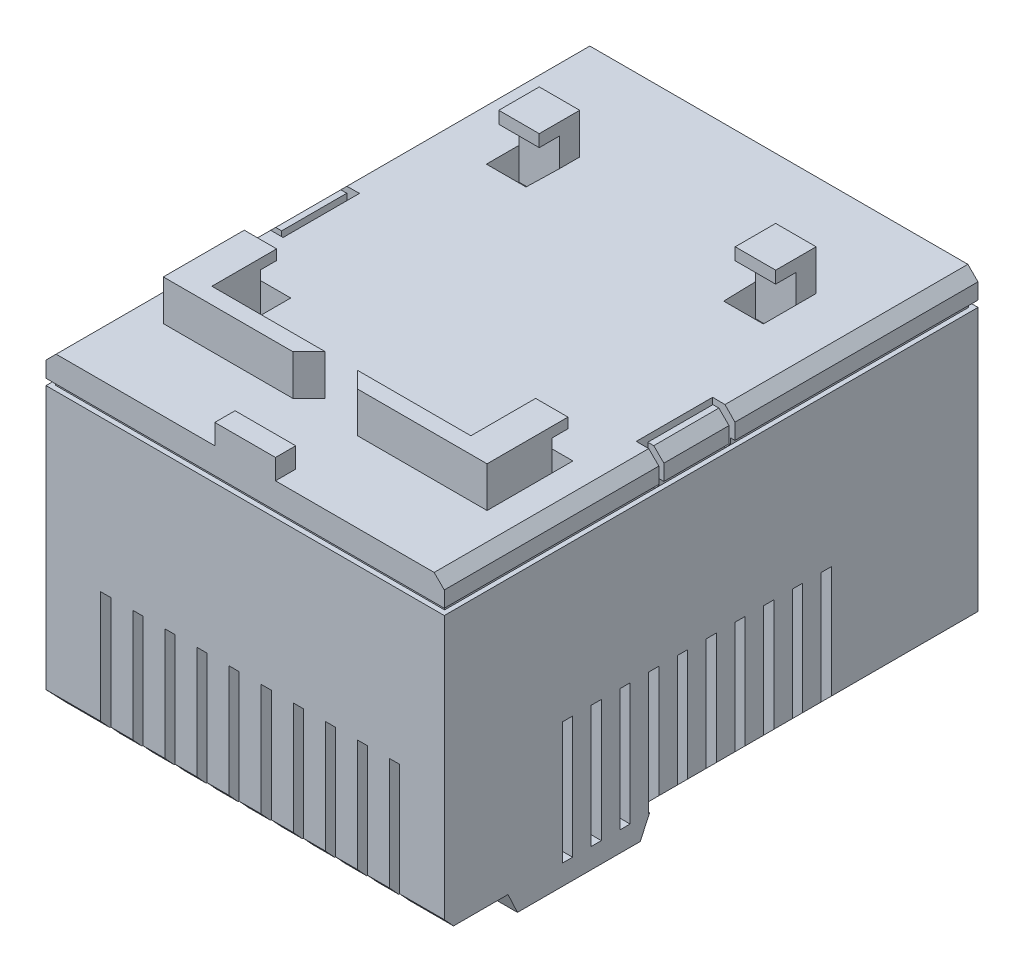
SolidWorks part; units mm, degrees
ref_plane "Спереди" through (0, 0, 0) normal (0, 0, 1) x (1, 0, 0)
ref_plane "Сверху" through (0, 0, 0) normal (0, 1, 0) x (1, 0, 0)
ref_plane "Справа" through (0, 0, 0) normal (1, 0, 0) x (0, 0, -1)
ref_plane "Плоскость1" through (0, -19.94, 0) normal (0, -1, 0) x (1, 0, 0)
sketch "Эскиз1" plane through (0, -19.94, 0) normal (0, -1, 0) x (1, 0, 0)
  line L0 (25, 0) -> (25, 67)
  line L1 (25, 67) -> (-25, 67)
  line L2 (-25, 67) -> (-25, 0)
  line L3 (-25, 0) -> (25, 0)
extrude "Бобышка-Вытянуть1" add sketch "Эскиз1" against normal blind 38.38
sketch "Эскиз2" plane through (0, 18.44, 0) normal (0, 1, 0) x (-1, 0, 0)
  line L0 (17.38, 12.7) -> (12.3, 12.7)
  line L1 (12.3, 12.7) -> (12.3, 15.24)
  line L2 (12.3, 15.24) -> (17.38, 15.24)
  line L3 (17.38, 15.24) -> (17.38, 12.7)
extrude "Бобышка-Вытянуть2" add sketch "Эскиз2" along normal blind 5.08
sketch "Эскиз3" plane through (0, 0, 15.24) normal (0, 0, 1) x (1, 0, 0)
  line L0 (-12.3, 21.996) -> (-17.38, 21.996)
  line L1 (-17.38, 21.996) -> (-17.38, 23.52)
  line L2 (-17.38, 23.52) -> (-12.3, 23.52)
  line L3 (-12.3, 23.52) -> (-12.3, 21.996)
extrude "Бобышка-Вытянуть3" add sketch "Эскиз3" along normal blind 2.54
sketch "Эскиз4" plane through (0, 18.44, 0) normal (0, 1, 0) x (-1, 0, 0)
  line L0 (-20.32, 56.95) -> (-4.064, 56.95)
  line L1 (-4.064, 56.95) -> (-4.064, 54.918)
  line L2 (-4.064, 54.918) -> (-16.256, 54.918)
  line L3 (-16.256, 54.918) -> (-16.256, 48.822)
  line L4 (-16.256, 48.822) -> (-20.32, 48.822)
  line L5 (-20.32, 48.822) -> (-20.32, 56.95)
extrude "Бобышка-Вытянуть4" add sketch "Эскиз4" along normal blind 5.08
sketch "Эскиз5" plane through (0, 0, 48.822) normal (0, 0, -1) x (-1, 0, 0)
  line L0 (-16.256, 23.52) -> (-16.256, 22.25)
  line L1 (-16.256, 22.25) -> (-20.32, 22.25)
  line L2 (-20.32, 22.25) -> (-20.32, 23.52)
  line L3 (-20.32, 23.52) -> (-16.256, 23.52)
extrude "Бобышка-Вытянуть5" add sketch "Эскиз5" along normal blind 2.032
sketch "Эскиз6" plane through (0, 18.44, 0) normal (0, 1, 0) x (-1, 0, 0)
  line L0 (16.256, 54.918) -> (4.064, 54.918)
  line L1 (4.064, 54.918) -> (4.064, 56.95)
  line L2 (4.064, 56.95) -> (20.32, 56.95)
  line L3 (20.32, 56.95) -> (20.32, 48.822)
  line L4 (20.32, 48.822) -> (16.256, 48.822)
  line L5 (16.256, 48.822) -> (16.256, 54.918)
extrude "Бобышка-Вытянуть6" add sketch "Эскиз6" along normal blind 5.08
sketch "Эскиз7" plane through (0, 0, 48.822) normal (0, 0, -1) x (-1, 0, 0)
  line L0 (20.32, 23.52) -> (20.32, 22.25)
  line L1 (20.32, 22.25) -> (16.256, 22.25)
  line L2 (16.256, 22.25) -> (16.256, 23.52)
  line L3 (16.256, 23.52) -> (20.32, 23.52)
extrude "Бобышка-Вытянуть7" add sketch "Эскиз7" along normal blind 2.032
sketch "Эскиз8" plane through (0, 18.44, 0) normal (0, 1, 0) x (-1, 0, 0)
  line L0 (-12.3, 12.7) -> (-17.38, 12.7)
  line L1 (-17.38, 12.7) -> (-17.38, 15.24)
  line L2 (-17.38, 15.24) -> (-12.3, 15.24)
  line L3 (-12.3, 15.24) -> (-12.3, 12.7)
extrude "Бобышка-Вытянуть8" add sketch "Эскиз8" along normal blind 5.08
sketch "Эскиз9" plane through (0, 0, 15.24) normal (0, 0, 1) x (1, 0, 0)
  line L0 (17.38, 21.996) -> (12.3, 21.996)
  line L1 (12.3, 21.996) -> (12.3, 23.52)
  line L2 (12.3, 23.52) -> (17.38, 23.52)
  line L3 (17.38, 23.52) -> (17.38, 21.996)
extrude "Бобышка-Вытянуть9" add sketch "Эскиз9" along normal blind 2.54
sketch "Эскиз10" plane through (0, -19.94, 0) normal (0, -1, 0) x (1, 0, 0)
  line L0 (-4.775, 47.47) -> (-6.045, 47.47)
  line L1 (-6.045, 47.47) -> (-6.045, 18.415)
  line L2 (-6.045, 18.415) -> (-4.775, 18.415)
  line L3 (-4.775, 18.415) -> (-4.775, 47.47)
extrude "Вырез-Вытянуть1" cut sketch "Эскиз10" against normal blind 2.54
sketch "Эскиз11" plane through (0, -19.94, 0) normal (0, -1, 0) x (1, 0, 0)
  line L0 (-8.805, 47.47) -> (-10.075, 47.47)
  line L1 (-10.075, 47.47) -> (-10.075, 18.415)
  line L2 (-10.075, 18.415) -> (-8.805, 18.415)
  line L3 (-8.805, 18.415) -> (-8.805, 47.47)
extrude "Вырез-Вытянуть2" cut sketch "Эскиз11" against normal blind 2.54
sketch "Эскиз12" plane through (0, -19.94, 0) normal (0, -1, 0) x (1, 0, 0)
  line L0 (-12.835, 47.47) -> (-14.105, 47.47)
  line L1 (-14.105, 47.47) -> (-14.105, 18.415)
  line L2 (-14.105, 18.415) -> (-12.835, 18.415)
  line L3 (-12.835, 18.415) -> (-12.835, 47.47)
extrude "Вырез-Вытянуть3" cut sketch "Эскиз12" against normal blind 2.54
sketch "Эскиз13" plane through (0, -19.94, 0) normal (0, -1, 0) x (1, 0, 0)
  line L0 (-16.865, 47.47) -> (-18.135, 47.47)
  line L1 (-18.135, 47.47) -> (-18.135, 18.415)
  line L2 (-18.135, 18.415) -> (-16.865, 18.415)
  line L3 (-16.865, 18.415) -> (-16.865, 47.47)
extrude "Вырез-Вытянуть4" cut sketch "Эскиз13" against normal blind 2.54
sketch "Эскиз14" plane through (0, -19.94, 0) normal (0, -1, 0) x (1, 0, 0)
  line L0 (19.405, 47.47) -> (18.135, 47.47)
  line L1 (18.135, 47.47) -> (18.135, 18.415)
  line L2 (18.135, 18.415) -> (19.405, 18.415)
  line L3 (19.405, 18.415) -> (19.405, 47.47)
extrude "Вырез-Вытянуть5" cut sketch "Эскиз14" against normal blind 2.54
sketch "Эскиз15" plane through (0, -19.94, 0) normal (0, -1, 0) x (1, 0, 0)
  line L0 (15.375, 47.47) -> (14.105, 47.47)
  line L1 (14.105, 47.47) -> (14.105, 18.415)
  line L2 (14.105, 18.415) -> (15.375, 18.415)
  line L3 (15.375, 18.415) -> (15.375, 47.47)
extrude "Вырез-Вытянуть6" cut sketch "Эскиз15" against normal blind 2.54
sketch "Эскиз16" plane through (0, -19.94, 0) normal (0, -1, 0) x (1, 0, 0)
  line L0 (11.345, 47.47) -> (10.075, 47.47)
  line L1 (10.075, 47.47) -> (10.075, 18.415)
  line L2 (10.075, 18.415) -> (11.345, 18.415)
  line L3 (11.345, 18.415) -> (11.345, 47.47)
extrude "Вырез-Вытянуть7" cut sketch "Эскиз16" against normal blind 2.54
sketch "Эскиз17" plane through (0, -19.94, 0) normal (0, -1, 0) x (1, 0, 0)
  line L0 (7.315, 47.47) -> (6.045, 47.47)
  line L1 (6.045, 47.47) -> (6.045, 18.415)
  line L2 (6.045, 18.415) -> (7.315, 18.415)
  line L3 (7.315, 18.415) -> (7.315, 47.47)
extrude "Вырез-Вытянуть8" cut sketch "Эскиз17" against normal blind 2.54
sketch "Эскиз18" plane through (0, -19.94, 0) normal (0, -1, 0) x (1, 0, 0)
  line L0 (3.285, 47.47) -> (2.015, 47.47)
  line L1 (2.015, 47.47) -> (2.015, 18.415)
  line L2 (2.015, 18.415) -> (3.285, 18.415)
  line L3 (3.285, 18.415) -> (3.285, 47.47)
extrude "Вырез-Вытянуть9" cut sketch "Эскиз18" against normal blind 2.54
sketch "Эскиз19" plane through (0, -19.94, 0) normal (0, -1, 0) x (1, 0, 0)
  line L0 (-10, 58.999) -> (25, 58.999)
  line L1 (25, 58.999) -> (25, 41.219)
  line L2 (25, 41.219) -> (-10, 41.219)
  arc A0 (-10, 41.219) -> (-10, 58.999) centre (-10, 50.109) cw
extrude "Бобышка-Вытянуть10" add sketch "Эскиз19" along normal blind 2.54
sketch "Эскиз20" plane through (0, -19.94, 0) normal (0, -1, 0) x (1, 0, 0)
  line L0 (-0.745, 18.415) -> (-0.745, 41.219)
  line L1 (-0.745, 41.219) -> (-2.015, 41.219)
  line L2 (-2.015, 41.219) -> (-2.015, 18.415)
  line L3 (-2.015, 18.415) -> (-0.745, 18.415)
extrude "Вырез-Вытянуть10" cut sketch "Эскиз20" against normal blind 2.54
sketch "Эскиз21" plane through (0, 0, 41.219) normal (0, 0, -1) x (-1, 0, 0)
  line L0 (0.745, -19.94) -> (2.015, -19.94)
  line L1 (2.015, -19.94) -> (2.015, -17.4)
  line L2 (2.015, -17.4) -> (0.745, -17.4)
  line L3 (0.745, -17.4) -> (0.745, -19.94)
extrude "Вырез-Вытянуть11" cut sketch "Эскиз21" against normal blind 6.251
sketch "Эскиз22" plane through (25, 0, 0) normal (1, 0, 0) x (0, 0, -1)
  line L0 (-52.1627, -4.588) -> (-52.1627, -19.94)
  line L1 (-52.1627, -19.94) -> (-50.8927, -19.94)
  line L2 (-50.8927, -19.94) -> (-50.8927, -4.588)
  line L3 (-50.8927, -4.588) -> (-52.1627, -4.588)
extrude "Вырез-Вытянуть12" cut sketch "Эскиз22" against normal blind 2.54
sketch "Эскиз23" plane through (25, 0, 0) normal (1, 0, 0) x (0, 0, -1)
  line L0 (-48.5541, -4.588) -> (-48.5541, -19.94)
  line L1 (-48.5541, -19.94) -> (-47.2841, -19.94)
  line L2 (-47.2841, -19.94) -> (-47.2841, -4.588)
  line L3 (-47.2841, -4.588) -> (-48.5541, -4.588)
extrude "Вырез-Вытянуть13" cut sketch "Эскиз23" against normal blind 2.54
sketch "Эскиз24" plane through (25, 0, 0) normal (1, 0, 0) x (0, 0, -1)
  line L0 (-44.9455, -4.588) -> (-44.9455, -19.94)
  line L1 (-44.9455, -19.94) -> (-43.6755, -19.94)
  line L2 (-43.6755, -19.94) -> (-43.6755, -4.588)
  line L3 (-43.6755, -4.588) -> (-44.9455, -4.588)
extrude "Вырез-Вытянуть14" cut sketch "Эскиз24" against normal blind 2.54
sketch "Эскиз25" plane through (0, 18.44, 0) normal (0, 1, 0) x (-1, 0, 0)
  line L0 (3.81, 64.46) -> (-3.81, 64.46)
  line L1 (-3.81, 64.46) -> (-3.81, 67)
  line L2 (-3.81, 67) -> (3.81, 67)
  line L3 (3.81, 67) -> (3.81, 64.46)
extrude "Бобышка-Вытянуть11" add sketch "Эскиз25" along normal blind 2.54
sketch "Эскиз26" plane through (25, 0, 0) normal (1, 0, 0) x (0, 0, -1)
  line L0 (-41.219, -19.94) -> (-40.0668, -19.94)
  line L1 (-40.0668, -19.94) -> (-40.0668, -4.588)
  line L2 (-40.0668, -4.588) -> (-41.3368, -4.588)
  line L3 (-41.3368, -4.588) -> (-41.3368, -19.94)
  line L4 (-41.3368, -19.94) -> (-41.219, -19.94)
extrude "Вырез-Вытянуть15" cut sketch "Эскиз26" against normal blind 2.54
sketch "Эскиз27" plane through (25, 0, 0) normal (1, 0, 0) x (0, 0, -1)
  line L0 (-37.7282, -4.588) -> (-37.7282, -19.94)
  line L1 (-37.7282, -19.94) -> (-36.4582, -19.94)
  line L2 (-36.4582, -19.94) -> (-36.4582, -4.588)
  line L3 (-36.4582, -4.588) -> (-37.7282, -4.588)
extrude "Вырез-Вытянуть16" cut sketch "Эскиз27" against normal blind 2.54
sketch "Эскиз28" plane through (25, 0, 0) normal (1, 0, 0) x (0, 0, -1)
  line L0 (-34.1195, -4.588) -> (-34.1195, -19.94)
  line L1 (-34.1195, -19.94) -> (-32.8495, -19.94)
  line L2 (-32.8495, -19.94) -> (-32.8495, -4.588)
  line L3 (-32.8495, -4.588) -> (-34.1195, -4.588)
extrude "Вырез-Вытянуть17" cut sketch "Эскиз28" against normal blind 2.54
sketch "Эскиз29" plane through (25, 0, 0) normal (1, 0, 0) x (0, 0, -1)
  line L0 (-30.5109, -4.588) -> (-30.5109, -19.94)
  line L1 (-30.5109, -19.94) -> (-29.2409, -19.94)
  line L2 (-29.2409, -19.94) -> (-29.2409, -4.588)
  line L3 (-29.2409, -4.588) -> (-30.5109, -4.588)
extrude "Вырез-Вытянуть18" cut sketch "Эскиз29" against normal blind 2.54
sketch "Эскиз30" plane through (25, 0, 0) normal (1, 0, 0) x (0, 0, -1)
  line L0 (-26.9023, -4.588) -> (-26.9023, -19.94)
  line L1 (-26.9023, -19.94) -> (-25.6323, -19.94)
  line L2 (-25.6323, -19.94) -> (-25.6323, -4.588)
  line L3 (-25.6323, -4.588) -> (-26.9023, -4.588)
extrude "Вырез-Вытянуть19" cut sketch "Эскиз30" against normal blind 2.54
sketch "Эскиз31" plane through (25, 0, 0) normal (1, 0, 0) x (0, 0, -1)
  line L0 (-23.2936, -4.588) -> (-23.2936, -19.94)
  line L1 (-23.2936, -19.94) -> (-22.0236, -19.94)
  line L2 (-22.0236, -19.94) -> (-22.0236, -4.588)
  line L3 (-22.0236, -4.588) -> (-23.2936, -4.588)
extrude "Вырез-Вытянуть20" cut sketch "Эскиз31" against normal blind 2.54
sketch "Эскиз32" plane through (25, 0, 0) normal (1, 0, 0) x (0, 0, -1)
  line L0 (-19.685, -4.588) -> (-19.685, -19.94)
  line L1 (-19.685, -19.94) -> (-18.415, -19.94)
  line L2 (-18.415, -19.94) -> (-18.415, -4.588)
  line L3 (-18.415, -4.588) -> (-19.685, -4.588)
extrude "Вырез-Вытянуть21" cut sketch "Эскиз32" against normal blind 2.54
sketch "Эскиз33" plane through (0, -19.94, 0) normal (0, -1, 0) x (1, 0, 0)
  line L0 (-22.46, 19.685) -> (-25, 19.685)
  line L1 (-25, 19.685) -> (-25, 18.415)
  line L2 (-25, 18.415) -> (-22.46, 18.415)
  line L3 (-22.46, 18.415) -> (-22.46, 19.685)
extrude "Вырез-Вытянуть22" cut sketch "Эскиз33" against normal blind 15.352
sketch "Эскиз34" plane through (0, -19.94, 0) normal (0, -1, 0) x (1, 0, 0)
  line L0 (-22.46, 23.2936) -> (-25, 23.2936)
  line L1 (-25, 23.2936) -> (-25, 22.0236)
  line L2 (-25, 22.0236) -> (-22.46, 22.0236)
  line L3 (-22.46, 22.0236) -> (-22.46, 23.2936)
extrude "Вырез-Вытянуть23" cut sketch "Эскиз34" against normal blind 15.352
sketch "Эскиз35" plane through (0, -19.94, 0) normal (0, -1, 0) x (1, 0, 0)
  line L0 (-22.46, 26.9023) -> (-25, 26.9023)
  line L1 (-25, 26.9023) -> (-25, 25.6323)
  line L2 (-25, 25.6323) -> (-22.46, 25.6323)
  line L3 (-22.46, 25.6323) -> (-22.46, 26.9023)
extrude "Вырез-Вытянуть24" cut sketch "Эскиз35" against normal blind 15.352
sketch "Эскиз36" plane through (0, -19.94, 0) normal (0, -1, 0) x (1, 0, 0)
  line L0 (-22.46, 30.5109) -> (-25, 30.5109)
  line L1 (-25, 30.5109) -> (-25, 29.2409)
  line L2 (-25, 29.2409) -> (-22.46, 29.2409)
  line L3 (-22.46, 29.2409) -> (-22.46, 30.5109)
extrude "Вырез-Вытянуть25" cut sketch "Эскиз36" against normal blind 15.352
sketch "Эскиз37" plane through (0, -19.94, 0) normal (0, -1, 0) x (1, 0, 0)
  line L0 (-22.46, 34.1195) -> (-25, 34.1195)
  line L1 (-25, 34.1195) -> (-25, 32.8495)
  line L2 (-25, 32.8495) -> (-22.46, 32.8495)
  line L3 (-22.46, 32.8495) -> (-22.46, 34.1195)
extrude "Вырез-Вытянуть26" cut sketch "Эскиз37" against normal blind 15.352
sketch "Эскиз38" plane through (0, -19.94, 0) normal (0, -1, 0) x (1, 0, 0)
  line L0 (-22.46, 37.7282) -> (-25, 37.7282)
  line L1 (-25, 37.7282) -> (-25, 36.4582)
  line L2 (-25, 36.4582) -> (-22.46, 36.4582)
  line L3 (-22.46, 36.4582) -> (-22.46, 37.7282)
extrude "Вырез-Вытянуть27" cut sketch "Эскиз38" against normal blind 15.352
sketch "Эскиз39" plane through (0, -19.94, 0) normal (0, -1, 0) x (1, 0, 0)
  line L0 (-22.46, 41.3368) -> (-25, 41.3368)
  line L1 (-25, 41.3368) -> (-25, 40.0668)
  line L2 (-25, 40.0668) -> (-22.46, 40.0668)
  line L3 (-22.46, 40.0668) -> (-22.46, 41.3368)
extrude "Вырез-Вытянуть28" cut sketch "Эскиз39" against normal blind 15.352
sketch "Эскиз40" plane through (0, -19.94, 0) normal (0, -1, 0) x (1, 0, 0)
  line L0 (-22.46, 44.9455) -> (-25, 44.9455)
  line L1 (-25, 44.9455) -> (-25, 43.6755)
  line L2 (-25, 43.6755) -> (-22.46, 43.6755)
  line L3 (-22.46, 43.6755) -> (-22.46, 44.9455)
extrude "Вырез-Вытянуть29" cut sketch "Эскиз40" against normal blind 15.352
sketch "Эскиз41" plane through (0, -19.94, 0) normal (0, -1, 0) x (1, 0, 0)
  line L0 (-22.46, 48.5541) -> (-25, 48.5541)
  line L1 (-25, 48.5541) -> (-25, 47.2841)
  line L2 (-25, 47.2841) -> (-22.46, 47.2841)
  line L3 (-22.46, 47.2841) -> (-22.46, 48.5541)
extrude "Вырез-Вытянуть30" cut sketch "Эскиз41" against normal blind 15.352
sketch "Эскиз42" plane through (-25, 0, 0) normal (-1, 0, 0) x (0, 0, 1)
  line L0 (52.1627, -19.94) -> (52.1627, -4.588)
  line L1 (52.1627, -4.588) -> (50.8927, -4.588)
  line L2 (50.8927, -4.588) -> (50.8927, -19.94)
  line L3 (50.8927, -19.94) -> (52.1627, -19.94)
extrude "Вырез-Вытянуть31" cut sketch "Эскиз42" against normal blind 2.54
sketch "Эскиз43" plane through (0, 0, 67) normal (0, 0, 1) x (1, 0, 0)
  line L0 (19.405, -19.94) -> (19.405, -4.588)
  line L1 (19.405, -4.588) -> (18.135, -4.588)
  line L2 (18.135, -4.588) -> (18.135, -19.94)
  line L3 (18.135, -19.94) -> (19.405, -19.94)
extrude "Вырез-Вытянуть32" cut sketch "Эскиз43" against normal blind 2.54
sketch "Эскиз44" plane through (0, 0, 67) normal (0, 0, 1) x (1, 0, 0)
  line L0 (-16.865, -19.94) -> (-16.865, -4.588)
  line L1 (-16.865, -4.588) -> (-18.135, -4.588)
  line L2 (-18.135, -4.588) -> (-18.135, -19.94)
  line L3 (-18.135, -19.94) -> (-16.865, -19.94)
extrude "Вырез-Вытянуть33" cut sketch "Эскиз44" against normal blind 2.54
sketch "Эскиз45" plane through (0, 0, 67) normal (0, 0, 1) x (1, 0, 0)
  line L0 (-12.835, -19.94) -> (-12.835, -4.588)
  line L1 (-12.835, -4.588) -> (-14.105, -4.588)
  line L2 (-14.105, -4.588) -> (-14.105, -19.94)
  line L3 (-14.105, -19.94) -> (-12.835, -19.94)
extrude "Вырез-Вытянуть34" cut sketch "Эскиз45" against normal blind 2.54
sketch "Эскиз46" plane through (0, 0, 67) normal (0, 0, 1) x (1, 0, 0)
  line L0 (-8.805, -19.94) -> (-8.805, -4.588)
  line L1 (-8.805, -4.588) -> (-10.075, -4.588)
  line L2 (-10.075, -4.588) -> (-10.075, -19.94)
  line L3 (-10.075, -19.94) -> (-8.805, -19.94)
extrude "Вырез-Вытянуть35" cut sketch "Эскиз46" against normal blind 2.54
sketch "Эскиз47" plane through (0, 0, 67) normal (0, 0, 1) x (1, 0, 0)
  line L0 (-4.775, -19.94) -> (-4.775, -4.588)
  line L1 (-4.775, -4.588) -> (-6.045, -4.588)
  line L2 (-6.045, -4.588) -> (-6.045, -19.94)
  line L3 (-6.045, -19.94) -> (-4.775, -19.94)
extrude "Вырез-Вытянуть36" cut sketch "Эскиз47" against normal blind 2.54
sketch "Эскиз48" plane through (0, 0, 67) normal (0, 0, 1) x (1, 0, 0)
  line L0 (-0.745, -19.94) -> (-0.745, -4.588)
  line L1 (-0.745, -4.588) -> (-2.015, -4.588)
  line L2 (-2.015, -4.588) -> (-2.015, -19.94)
  line L3 (-2.015, -19.94) -> (-0.745, -19.94)
extrude "Вырез-Вытянуть37" cut sketch "Эскиз48" against normal blind 2.54
sketch "Эскиз49" plane through (0, 0, 67) normal (0, 0, 1) x (1, 0, 0)
  line L0 (3.285, -19.94) -> (3.285, -4.588)
  line L1 (3.285, -4.588) -> (2.015, -4.588)
  line L2 (2.015, -4.588) -> (2.015, -19.94)
  line L3 (2.015, -19.94) -> (3.285, -19.94)
extrude "Вырез-Вытянуть38" cut sketch "Эскиз49" against normal blind 2.54
sketch "Эскиз50" plane through (0, 0, 67) normal (0, 0, 1) x (1, 0, 0)
  line L0 (7.315, -19.94) -> (7.315, -4.588)
  line L1 (7.315, -4.588) -> (6.045, -4.588)
  line L2 (6.045, -4.588) -> (6.045, -19.94)
  line L3 (6.045, -19.94) -> (7.315, -19.94)
extrude "Вырез-Вытянуть39" cut sketch "Эскиз50" against normal blind 2.54
sketch "Эскиз51" plane through (0, 0, 67) normal (0, 0, 1) x (1, 0, 0)
  line L0 (11.345, -19.94) -> (11.345, -4.588)
  line L1 (11.345, -4.588) -> (10.075, -4.588)
  line L2 (10.075, -4.588) -> (10.075, -19.94)
  line L3 (10.075, -19.94) -> (11.345, -19.94)
extrude "Вырез-Вытянуть40" cut sketch "Эскиз51" against normal blind 2.54
sketch "Эскиз52" plane through (0, 0, 67) normal (0, 0, 1) x (1, 0, 0)
  line L0 (15.375, -19.94) -> (15.375, -4.588)
  line L1 (15.375, -4.588) -> (14.105, -4.588)
  line L2 (14.105, -4.588) -> (14.105, -19.94)
  line L3 (14.105, -19.94) -> (15.375, -19.94)
extrude "Вырез-Вытянуть41" cut sketch "Эскиз52" against normal blind 2.54
sketch "Эскиз53" plane through (0, -19.94, 0) normal (0, -1, 0) x (1, 0, 0)
  line L0 (12.8588, 11.9062) -> (-12.8588, 11.9062)
  line L1 (-12.8588, 7.1438) -> (12.8588, 7.1438)
  arc A0 (12.8588, 7.1438) -> (12.8588, 11.9062) centre (12.8588, 9.525) ccw
  arc A1 (-12.8588, 11.9062) -> (-12.8588, 7.1438) centre (-12.8588, 9.525) ccw
extrude "Вырез-Вытянуть42" cut sketch "Эскиз53" against normal blind 1.27
draft "Уклон1" type of draft neutral plane draft angle 45 faces to draft 1 parameters "D1"=45
draft "Уклон2" type of draft neutral plane draft angle 45 faces to draft 1 parameters "D1"=45
draft "Уклон3" type of draft neutral plane draft angle 25 faces to draft 3 parameters "D1"=25
hole_wizard "Отверстие с зазором M3.51" positions "Эскиз55" profile "Эскиз54" hole size "M3.5" standard "Ansi Metric"
sketch "Эскиз55" plane through (0, 0, 0) normal (0, 0, -1) x (-1, 0, 0)
  point P0 (-12.3825, 1.3455)
  point P1 (-7.62, 1.3455)
  point P2 (-2.8575, 1.3455)
  point P3 (1.905, 1.3455)
  point P4 (6.6675, 1.3455)
  point P5 (11.43, 1.3455)
sketch "Эскиз54" plane through (12.3825, 1.3455, 0) normal (1, 0, 0) x (0, 1, 0)
  line L0 (0, 0) -> (0, 2.8575)
  line L1 (0, 2.8575) -> (1.905, 2.8575)
  line L2 (1.905, 2.8575) -> (1.905, 0)
  line L5 (1.905, 0) -> (0, 0)
  line L10 (0, 2.8575) -> (-1.905, 2.8575) construction
  line L11 (0, -6.35) -> (0, 107.95) construction
  dimension "Диаметр отверстия" = 3.81
  dimension "Глубина отверстия" = 2.8575
  dimension "Угол заточки сверла" = 180
hole_wizard "Отверстие1" positions "Эскиз57" profile "Эскиз56" legacy
sketch "Эскиз57" plane through (0, -22.48, 0) normal (0, -1, 0) x (-1, 0, 0)
  point P0 (-11.8767, -50.109)
  point P1 (10, -50.109)
sketch "Эскиз56" plane through (11.8767, -22.48, 50.109) normal (1, 0, 0) x (0, 0, -1)
  line L0 (0, 0) -> (0, 0.254)
  line L1 (0, 0.254) -> (5.08, 0.254)
  line L2 (5.08, 0.254) -> (5.08, 0)
  line L3 (5.08, 0) -> (0, 0)
  line L4 (0, 110) -> (0, -10) construction
  dimension "Диаметр" = 10.16
  dimension "Глубина" = 0.254
hole_wizard "Отверстие с зазором M3.52" positions "Эскиз59" profile "Эскиз58" hole size "M3.5" standard "Ansi Metric"
sketch "Эскиз59" plane through (0, -18.67, 0) normal (0, -1, 0) x (-1, 0, 0)
  point P0 (-12.3825, -9.525)
  point P1 (-7.62, -9.525)
  point P2 (-2.8575, -9.525)
  point P3 (1.905, -9.525)
  point P4 (6.6675, -9.525)
  point P5 (11.43, -9.525)
sketch "Эскиз58" plane through (12.3825, -18.67, 9.525) normal (1, 0, 0) x (0, 0, -1)
  line L0 (0, 0) -> (0, 3.33)
  line L1 (0, 3.33) -> (1.905, 3.33)
  line L2 (1.905, 3.33) -> (1.905, 0)
  line L5 (1.905, 0) -> (0, 0)
  line L10 (0, 3.33) -> (-1.905, 3.33) construction
  line L11 (0, -6.35) -> (0, 107.95) construction
  dimension "Диаметр отверстия" = 3.81
  dimension "Глубина отверстия" = 3.33
  dimension "Угол заточки сверла" = 180
chamfer "Фаска1" distance 1.27 angle 45 20 edges at (-25, -19.94, 9.2075) (25, -19.94, 28.0716) (25, 18.44, 33.5) (-25, -19.94, 46.1148) (25, -19.94, 35.2889) (-25, -19.94, 42.5061) (-25, -19.94, 38.8975) (-25, -19.94, 49.7234) (-25, -19.94, 35.2889) (25, -19.94, 31.6802) (-25, -19.94, 31.6802) (25, -19.94, 38.8975) (-25, -19.94, 28.0716) (25, -19.94, 9.2075) (-25, -19.94, 24.463) (-25, -19.94, 59.5814) (-25, -19.94, 20.8543) (-25, 18.44, 33.5) (25, -19.94, 20.8543) (25, -19.94, 24.463)
sketch "Эскиз60" plane through (25, 0, 0) normal (1, 0, 0) x (0, 0, -1)
  line L0 (-65.8434, -19.94) -> (-67, -18.67)
  line L1 (-67, -18.67) -> (-67.9766, -18.67)
  line L2 (-67.9766, -18.67) -> (-67.9766, -20.433)
  line L3 (-67.9766, -20.433) -> (-65.8434, -20.433)
  line L4 (-65.8434, -20.433) -> (-65.8434, -19.94)
extrude "Вырез-Вытянуть43" cut sketch "Эскиз60" against normal up to surface (50 mm away)
sketch "Эскиз61" plane through (0, -22.226, 0) normal (0, -1, 0) x (1, 0, 0)
  circle A0 centre (-10, 50.109) radius 4.8699
  circle A1 centre (-10, 50.109) radius 4.5414
  circle A2 centre (11.8767, 50.109) radius 4.8744
  circle A3 centre (11.8767, 50.109) radius 4.5621
extrude "Вырез-Вытянуть44" cut sketch "Эскиз61" against normal blind 2
sketch "Эскиз62" plane through (0, -22.226, 0) normal (0, -1, 0) x (1, 0, 0)
  line L0 (-8.0201, 51.1697) -> (-11.0607, 48.1291)
  line L1 (-11.0607, 48.1291) -> (-11.9799, 49.0483)
  line L2 (-11.9799, 49.0483) -> (-8.9393, 52.0889)
  line L3 (-8.9393, 52.0889) -> (-8.0201, 51.1697)
  line L4 (13.5284, 51.6311) -> (11.3449, 47.9268)
  line L5 (11.3449, 47.9268) -> (10.225, 48.5869)
  line L6 (10.225, 48.5869) -> (12.4085, 52.2912)
  line L7 (12.4085, 52.2912) -> (13.5284, 51.6311)
extrude "Вырез-Вытянуть45" cut sketch "Эскиз62" against normal blind 2
sketch "Эскиз63" plane through (0, -15.34, 0) normal (0, -1, 0) x (1, 0, 0)
  circle A0 centre (-11.43, 9.525) radius 1.7849
  circle A1 centre (-11.43, 9.525) radius 1.669
extrude "Вырез-Вытянуть46" cut sketch "Эскиз63" against normal blind 2
sketch "Эскиз64" plane through (0, -15.34, 0) normal (0, -1, 0) x (1, 0, 0)
  line L0 (-10.1532, 10.7545) -> (-12.8801, 8.5051)
  line L1 (-12.8801, 8.5051) -> (-12.7247, 8.2963)
  line L2 (-12.7247, 8.2963) -> (-9.9775, 10.5624)
  line L3 (-9.9775, 10.5624) -> (-10.1532, 10.7545)
extrude "Вырез-Вытянуть47" cut sketch "Эскиз64" against normal blind 2
pattern_linear "Линейный массив1" count 6 spacing 4.75 along (1, 0, 0) of "Вырез-Вытянуть46", "Вырез-Вытянуть47"
sketch "Эскиз65" plane through (0, 0, 0) normal (0, 0, -1) x (-1, 0, 0)
  line L0 (19, -15.94) -> (17, -15.94)
  line L1 (19, -15.94) -> (19, 8.06)
  line L2 (19, 8.06) -> (17, 8.06)
  line L3 (17, -15.94) -> (17, 8.06)
  line L4 (16, -15.94) -> (14, -15.94)
  line L5 (16, -15.94) -> (16, -1.94)
  line L6 (16, -1.94) -> (14, -1.94)
  line L7 (14, -15.94) -> (14, -1.94)
  line L8 (-17, -15.94) -> (-19, -15.94)
  line L9 (-17, -15.94) -> (-17, 8.06)
  line L10 (-17, 8.06) -> (-19, 8.06)
  line L11 (-19, -15.94) -> (-19, 8.06)
  line L12 (13, -15.94) -> (11, -15.94)
  line L13 (13, -15.94) -> (13, -1.94)
  line L14 (13, -1.94) -> (11, -1.94)
  line L15 (11, -15.94) -> (11, -1.94)
  line L16 (10, -15.94) -> (8, -15.94)
  line L17 (10, -15.94) -> (10, -1.94)
  line L18 (10, -1.94) -> (8, -1.94)
  line L19 (8, -15.94) -> (8, -1.94)
  line L20 (7, -15.94) -> (5, -15.94)
  line L21 (7, -15.94) -> (7, -1.94)
  line L22 (7, -1.94) -> (5, -1.94)
  line L23 (5, -15.94) -> (5, -1.94)
  line L24 (4, -15.94) -> (2, -15.94)
  line L25 (4, -15.94) -> (4, -1.94)
  line L26 (4, -1.94) -> (2, -1.94)
  line L27 (2, -15.94) -> (2, -1.94)
  line L28 (1, -15.94) -> (-1, -15.94)
  line L29 (1, -15.94) -> (1, -1.94)
  line L30 (1, -1.94) -> (-1, -1.94)
  line L31 (-1, -15.94) -> (-1, -1.94)
  line L32 (-2, -15.94) -> (-4, -15.94)
  line L33 (-2, -15.94) -> (-2, -1.94)
  line L34 (-2, -1.94) -> (-4, -1.94)
  line L35 (-4, -15.94) -> (-4, -1.94)
  line L36 (-5, -15.94) -> (-7, -15.94)
  line L37 (-5, -15.94) -> (-5, -1.94)
  line L38 (-5, -1.94) -> (-7, -1.94)
  line L39 (-7, -15.94) -> (-7, -1.94)
  line L40 (-8, -15.94) -> (-10, -15.94)
  line L41 (-8, -15.94) -> (-8, -1.94)
  line L42 (-8, -1.94) -> (-10, -1.94)
  line L43 (-10, -15.94) -> (-10, -1.94)
  line L44 (-11, -15.94) -> (-13, -15.94)
  line L45 (-11, -15.94) -> (-11, -1.94)
  line L46 (-11, -1.94) -> (-13, -1.94)
  line L47 (-13, -15.94) -> (-13, -1.94)
  line L48 (-14, -15.94) -> (-16, -15.94)
  line L49 (-14, -15.94) -> (-14, -1.94)
  line L50 (-14, -1.94) -> (-16, -1.94)
  line L51 (-16, -15.94) -> (-16, -1.94)
extrude "Вырез-Вытянуть48" cut sketch "Эскиз65" against normal blind 2
sketch "Эскиз66" plane through (0, 18.44, 0) normal (0, 1, 0) x (-1, 0, 0)
  line L0 (25, 40.0668) -> (22.1658, 40.0668)
  line L1 (22.1658, 40.0668) -> (22.1658, 30.4778)
  line L2 (22.1658, 30.4778) -> (25, 30.5109)
  line L3 (25, 30.5109) -> (25, 31.2599)
  line L4 (25, 31.2599) -> (22.9834, 31.2599)
  line L5 (22.9834, 31.2599) -> (22.9834, 39.434)
  line L6 (22.9834, 39.434) -> (25, 39.434)
  line L7 (25, 39.434) -> (25, 40.0668)
  line L8 (-25, 39.434) -> (-25, 40.0668)
  line L9 (-22.9834, 39.434) -> (-25, 39.434)
  line L10 (-22.9834, 31.2599) -> (-22.9834, 39.434)
  line L11 (-25, 31.2599) -> (-22.9834, 31.2599)
  line L12 (-25, 30.5109) -> (-25, 31.2599)
  line L13 (-22.1658, 30.4778) -> (-25, 30.5109)
  line L14 (-22.1658, 40.0668) -> (-22.1658, 30.4778)
  line L15 (-25, 40.0668) -> (-22.1658, 40.0668)
extrude "Вырез-Вытянуть49" cut sketch "Эскиз66" against normal blind 4
sketch "Эскиз67" plane through (0, 18.44, 0) normal (0, 1, 0) x (-1, 0, 0)
  line L0 (20.32, 48.822) -> (20.32, 46.1692)
  line L1 (20.32, 46.1692) -> (15.1073, 46.1692)
  line L2 (15.1073, 46.1692) -> (15.1073, 54.0423)
  line L3 (15.1073, 54.0423) -> (11.257, 54.0423)
  line L4 (11.257, 54.0423) -> (11.257, 54.918)
  line L5 (11.257, 54.918) -> (16.256, 54.918)
  line L6 (16.256, 54.918) -> (16.256, 48.822)
  line L7 (16.256, 48.822) -> (20.32, 48.822)
  line L8 (17.38, 15.24) -> (17.38, 19.3318)
  line L9 (17.38, 19.3318) -> (12.4063, 19.3318)
  line L10 (12.4063, 19.3318) -> (12.3, 15.24)
  line L11 (12.3, 15.24) -> (17.38, 15.24)
  line L12 (-12.3, 15.24) -> (-17.38, 15.24)
  line L13 (-12.4063, 19.3318) -> (-12.3, 15.24)
  line L14 (-17.38, 19.3318) -> (-12.4063, 19.3318)
  line L15 (-17.38, 15.24) -> (-17.38, 19.3318)
  line L16 (-16.256, 48.822) -> (-20.32, 48.822)
  line L17 (-16.256, 54.918) -> (-16.256, 48.822)
  line L18 (-11.257, 54.918) -> (-16.256, 54.918)
  line L19 (-11.257, 54.0423) -> (-11.257, 54.918)
  line L20 (-15.1073, 54.0423) -> (-11.257, 54.0423)
  line L21 (-15.1073, 46.1692) -> (-15.1073, 54.0423)
  line L22 (-20.32, 46.1692) -> (-15.1073, 46.1692)
  line L23 (-20.32, 48.822) -> (-20.32, 46.1692)
extrude "Вырез-Вытянуть50" cut sketch "Эскиз67" against normal blind 4
sketch "Эскиз68" plane through (0, 0, 67) normal (0, 0, 1) x (1, 0, 0)
  line L0 (-25.7329, 15.1829) -> (-24.4119, 15.1829)
  line L1 (-25.7329, 15.1829) -> (-25.7329, 14.3903)
  line L2 (-25.7329, 14.3903) -> (-24.4119, 14.3903)
  line L3 (-24.4119, 15.1829) -> (-24.4119, 14.3903)
  line L4 (24.4119, 15.1829) -> (24.4119, 14.3903)
  line L5 (25.7329, 14.3903) -> (24.4119, 14.3903)
  line L6 (25.7329, 15.1829) -> (25.7329, 14.3903)
  line L7 (25.7329, 15.1829) -> (24.4119, 15.1829)
extrude "Вырез-Вытянуть51" cut sketch "Эскиз68" against normal up to surface (67 mm away)
sketch "Эскиз69" plane through (-25, 0, 0) normal (-1, 0, 0) x (0, 0, 1)
  line L0 (-0.5195, 15.1828) -> (0.6338, 15.1828)
  line L1 (-0.5195, 15.1828) -> (-0.5195, 14.3903)
  line L2 (-0.5195, 14.3903) -> (0.6338, 14.3903)
  line L3 (0.6338, 15.1828) -> (0.6338, 14.3903)
  line L4 (66.373, 15.1829) -> (67.4331, 15.1829)
  line L5 (66.373, 15.1829) -> (66.373, 14.3903)
  line L6 (66.373, 14.3903) -> (67.4331, 14.3903)
  line L7 (67.4331, 15.1829) -> (67.4331, 14.3903)
extrude "Вырез-Вытянуть52" cut sketch "Эскиз69" against normal up to surface (50 mm away)
